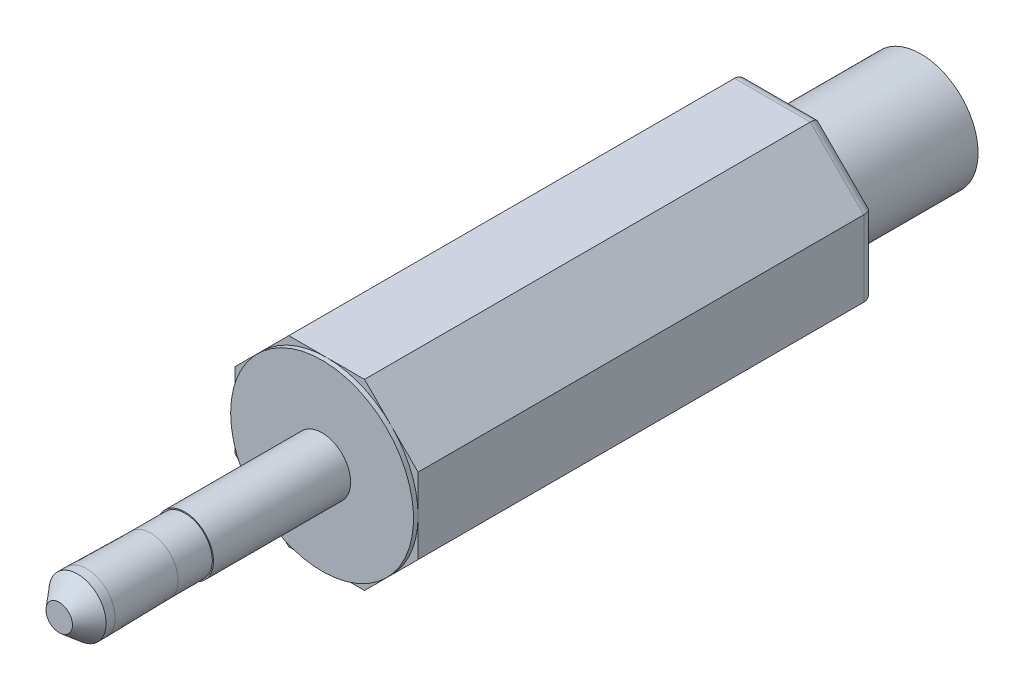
SolidWorks part; units mm, degrees
ref_plane "Plan de face" through (0, 0, 0) normal (0, 0, 1) x (1, 0, 0)
ref_plane "Plan de dessus" through (0, 0, 0) normal (0, 1, 0) x (1, 0, 0)
ref_plane "Plan de droite" through (0, 0, 0) normal (1, 0, 0) x (0, 0, -1)
sketch "Esquisse1" plane through (0, 0, 0) normal (0, 0, 1) x (1, 0, 0)
  circle A0 centre (0, 0) radius 1.25
  dimension "D1" = 2.5
extrude "Extrusion1" add sketch "Esquisse1" along normal blind 6
sketch "Esquisse2" plane through (0, 0, 6) normal (0, 0, 1) x (1, 0, 0)
  circle A0 centre (0, 0) radius 1.2
extrude "Extrusion2" add sketch "Esquisse2" along normal blind 1.5
sketch "Esquisse3" plane through (0, 0, 7.5) normal (0, 0, 1) x (1, 0, 0)
  circle A0 centre (0, 0) radius 1.25
  dimension "D1" = 2.5
extrude "Extrusion3" add sketch "Esquisse3" along normal blind 4
chamfer "Chanfrein1" distance 2.8 angle 1 1 edges at (1.25, 0, 7.5)
chamfer "Chanfrein2" distance 0.8 angle 40 1 edges at (1.25, 0, 11.5)
sketch "Esquisse4" plane through (0, 0, 0) normal (0, 0, -1) x (-1, 0, 0)
  circle A0 centre (0, 0) radius 4
  dimension "D1" = 8
extrude "Extrusion4" add sketch "Esquisse4" along normal blind 0.2
sketch "Esquisse7" plane through (0, 0, -0.2) normal (0, 0, -1) x (-1, 0, 0)
  circle A0 centre (0, 0) radius 2.5
  dimension "D1" = 5
extrude "Extrusion7" add sketch "Esquisse7" along normal blind 3
sketch "Esquisse9" plane through (0, 0, -0.2) normal (0, 0, -1) x (-1, 0, 0)
  line L1 (-1.0597, 2.2643) -> (1.0597, 2.2643)
  line L2 (-1.0597, 2.2643) -> (-1.0597, 2.6643)
  line L3 (-1.0597, 2.6643) -> (1.0597, 2.6643)
  line L4 (1.0597, 2.2643) -> (1.0597, 2.6643)
  circle A0 centre (0, 0) radius 2.5 construction
  dimension "D1" = 0.4
extrude "Extrusion8" add sketch "Esquisse9" along normal blind 10
sketch "Esquisse10" plane through (0, 2.2643, 0) normal (0, -1, 0) x (1, 0, 0)
  line L0 (1.0597, -10.2) -> (1.0597, -3.2) construction
  line L1 (1.0597, -10.2) -> (-1.0597, -10.2) construction
  circle A0 centre (0.0597, -8.2) radius 0.3733
  dimension "D1" = 1
  dimension "D2" = 2
extrude "Enlèv. mat.-Extru.1" cut sketch "Esquisse10" against normal up to next
sketch "Esquisse11" plane through (0, 2.2643, 0) normal (0, -1, 0) x (1, 0, 0)
  line L1 (-1.0597, -10.2) -> (-0.6597, -10.2)
  line L2 (-1.0597, -10.2) -> (-1.0597, -8.7748)
  line L3 (-1.0597, -8.7748) -> (-0.6597, -8.7748)
  line L4 (-0.6597, -10.2) -> (-0.6597, -8.7748)
  line L5 (1.0597, -10.2) -> (0.6597, -10.2)
  line L6 (1.0597, -10.2) -> (1.0597, -8.7748)
  line L7 (1.0597, -8.7748) -> (0.6597, -8.7748)
  line L8 (0.6597, -10.2) -> (0.6597, -8.7748)
  dimension "D1" = 0.4
  dimension "D2" = 0.4
extrude "Extrusion9" add sketch "Esquisse11" along normal blind 2.3
sketch "Esquisse12" plane through (0, 0, -3.2) normal (0, 0, -1) x (-1, 0, 0)
  line L2 (-1, 0) -> (-1, -2)
  line L3 (-1, -2) -> (1, -2)
  line L4 (1, 0) -> (1, -2)
  arc A0 (1, 0) -> (-1, 0) centre (0, 0) ccw
  dimension "D1" = 2
  dimension "D2" = 2
extrude "Extrusion10" add sketch "Esquisse12" along normal blind 0.4
sketch "Esquisse13" plane through (0, 0, -3.6) normal (0, 0, -1) x (-1, 0, 0)
  line L0 (1, -2) -> (1, 0) construction
  line L1 (-1, -2) -> (1, -2)
  line L2 (-1, -2) -> (-1, -1.6)
  line L3 (-1, -1.6) -> (1, -1.6)
  line L4 (1, -2) -> (1, -1.6)
  dimension "D1" = 0.4
extrude "Extrusion11" add sketch "Esquisse13" along normal blind 2
sketch "Esquisse14" plane through (0, -2, 0) normal (0, -1, 0) x (1, 0, 0)
  circle A0 centre (0, -4.5484) radius 0.5
  dimension "D1" = 1
extrude "Enlèv. mat.-Extru.2" cut sketch "Esquisse14" against normal up to next
fillet "Congé2" radius 0.2 11 edges at (-0.8597, -0.0357, -8.7748) (-0.8597, -0.0357, -10.2) (0.8597, -0.0357, -8.7748) (0.8597, -0.0357, -10.2) (-1, -1.8, -5.6) (1, -1.8, -5.6) (-1.0597, 2.6643, -5.2) (-1.0597, 1.3143, -10.2) (0, 2.6643, -10.2) (1.0597, 2.6643, -5.2) (1.0597, 1.3143, -10.2)
sketch "Esquisse5" plane through (0, 0, -0.2) normal (0, 0, -1) x (-1, 0, 0)
  line L0 (-1.6569, -4) -> (1.6569, -4)
  line L1 (-4, -1.6569) -> (-1.6569, -4)
  line L2 (-4, 1.6569) -> (-4, -1.6569)
  line L3 (-1.6569, 4) -> (-4, 1.6569)
  line L4 (1.6569, 4) -> (-1.6569, 4)
  line L5 (4, 1.6569) -> (1.6569, 4)
  line L6 (4, -1.6569) -> (4, 1.6569)
  line L7 (1.6569, -4) -> (4, -1.6569)
  circle A0 centre (0, 0) radius 4 construction
  dimension "D1" = 8
extrude "Extrusion5" add sketch "Esquisse5" along normal blind 20
sketch "Esquisse6" plane through (0, 0, -20.2) normal (0, 0, -1) x (-1, 0, 0)
  circle A0 centre (0, 0) radius 2.5
  dimension "D1" = 5
extrude "Extrusion6" add sketch "Esquisse6" along normal blind 6
shell "Coque1" thickness 0.5
fillet "Congé1" radius 0.5 8 edges at (2.8284, 2.8284, -20.2) (0, 4, -20.2) (-2.8284, 2.8284, -20.2) (4, 0, -20.2) (2.8284, -2.8284, -20.2) (0, -4, -20.2) (-2.8284, -2.8284, -20.2) (-4, 0, -20.2)
